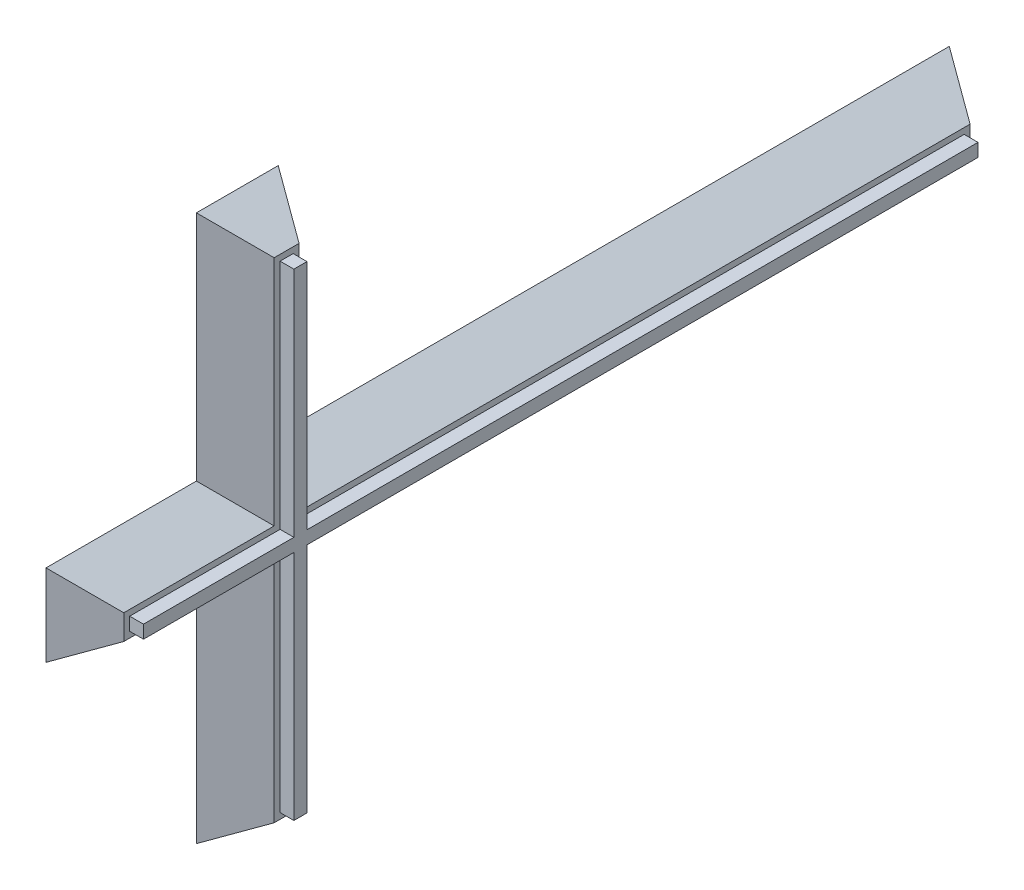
SolidWorks part; units mm, degrees
ref_plane "Front Plane" through (0, 0, 0) normal (1, 0, 0) x (0, 1, 0)
ref_plane "Top Plane" through (0, 0, 0) normal (0, 0, 1) x (0, 1, 0)
ref_plane "Right Plane" through (0, 0, 0) normal (0, 1, 0) x (-1, 0, 0)
sketch "sk orig cross" plane through (0, 0, 0) normal (1, 0, 0) x (0, 1, 0)
  line B0 (-24.503, 1485.7458) -> (275.497, 1485.7458)
  line B1 (275.497, 1485.7458) -> (275.497, 935.7458)
  line B2 (275.497, 935.7458) -> (1125.497, 935.7458)
  line B3 (1125.497, 935.7458) -> (1125.497, 635.7458)
  line B4 (1125.497, 635.7458) -> (275.497, 635.7458)
  line B5 (275.497, 635.7458) -> (275.497, -1814.2542)
  line B6 (275.497, -1814.2542) -> (-24.503, -1814.2542)
  line B7 (-24.503, -1814.2542) -> (-24.503, 635.7458)
  line B8 (-24.503, 635.7458) -> (-874.503, 635.7458)
  line B9 (-874.503, 635.7458) -> (-874.503, 935.7458)
  line B10 (-874.503, 935.7458) -> (-24.503, 935.7458)
  line B11 (-24.503, 935.7458) -> (-24.503, 1485.7458)
sketch_block_instance "sk Cross-1"
sketch_block "sk Cross" parameters "D1"=342.637, "D2"=300, "D3"=300, "D4"=300
sketch "Sketch2" plane through (0, 0, 0) normal (1, 0, 0) x (0, 1, 0)
  line L0 (-20.75, 97) -> (20.75, 97)
  line L1 (20.75, 97) -> (20.75, 20.75)
  line L2 (20.75, 20.75) -> (138.525, 20.75)
  line L3 (138.525, 20.75) -> (138.525, -20.75)
  line L4 (138.525, -20.75) -> (20.75, -20.75)
  line L5 (20.75, -20.75) -> (20.75, -361)
  line L6 (20.75, -361) -> (-20.75, -361)
  line L7 (-20.75, -361) -> (-20.75, -20.75)
  line L8 (-20.75, -20.75) -> (-138.475, -20.75)
  line L9 (-138.475, -20.75) -> (-138.475, 20.75)
  line L10 (-138.475, 20.75) -> (-20.75, 20.75)
  line L11 (-20.75, 20.75) -> (-20.75, 97)
  point P12 (138.525, 0)
  point P13 (0, 97)
  dimension "D1" = 458
  dimension "D2" = 277
  dimension "D3" = 97
  dimension "D4" = 41.5
  dimension "D5" = 41.5
  dimension "D6" = 117.725
extrude "Boss-Extrude1" add sketch "Sketch2" along normal blind 25 draft 30 contours L9 L10 L11 L0 L1 L2 L3 L4 L5 L6 L7 L8
sketch "Sketch3" plane through (25, 0, 0) normal (1, 0, 0) x (0, 1, 0)
  line L25 (-121.0412, -3.3162) -> (-3.3162, -3.3162)
  line L26 (-3.3162, -3.3162) -> (-3.3162, -343.5662)
  line L27 (-3.3162, -343.5662) -> (3.3162, -343.5662)
  line L28 (3.3162, -343.5662) -> (3.3162, -3.3162)
  line L29 (3.3162, -3.3162) -> (121.0912, -3.3162)
  line L30 (121.0912, -3.3162) -> (121.0912, 3.3162)
  line L31 (121.0912, 3.3162) -> (3.3162, 3.3162)
  line L32 (3.3162, 3.3162) -> (3.3162, 79.5662)
  line L33 (3.3162, 79.5662) -> (-3.3162, 79.5662)
  line L34 (-3.3162, 79.5662) -> (-3.3162, 3.3162)
  line L35 (-3.3162, 3.3162) -> (-121.0412, 3.3162)
  line L36 (-121.0412, 3.3162) -> (-121.0412, -3.3162)
  line L37 (-121.0412, -3.3162) -> (-3.3162, -3.3162)
  line L38 (-3.3162, -3.3162) -> (-3.3162, -343.5662)
  line L39 (-3.3162, -343.5662) -> (3.3162, -343.5662)
  line L40 (3.3162, -343.5662) -> (3.3162, -3.3162)
  line L41 (3.3162, -3.3162) -> (121.0912, -3.3162)
  line L42 (121.0912, -3.3162) -> (121.0912, 3.3162)
  line L43 (121.0912, 3.3162) -> (3.3162, 3.3162)
  line L44 (3.3162, 3.3162) -> (3.3162, 79.5662)
  line L45 (3.3162, 79.5662) -> (-3.3162, 79.5662)
  line L46 (-3.3162, 79.5662) -> (-3.3162, 3.3162)
  line L47 (-3.3162, 3.3162) -> (-121.0412, 3.3162)
  line L48 (-121.0412, 3.3162) -> (-121.0412, -3.3162)
  dimension "D1" = 3
extrude "Boss-Extrude2" add sketch "Sketch3" along normal blind 7
